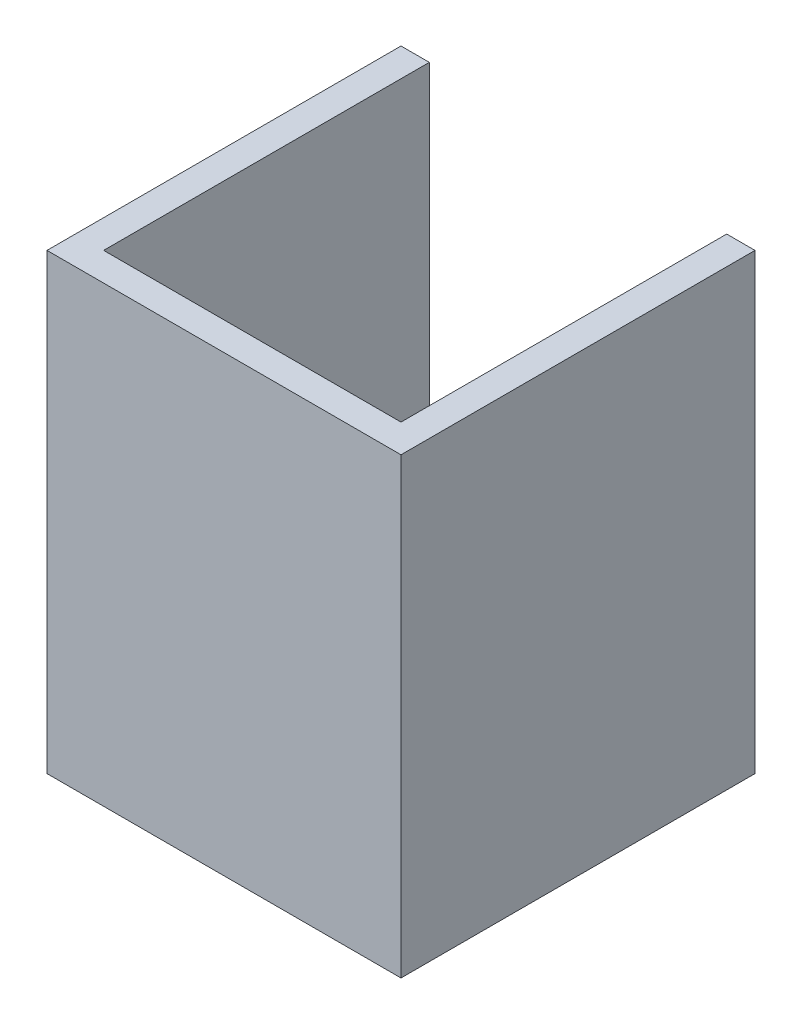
SolidWorks part; units mm, degrees
ref_plane "Front Plane" through (0, 0, 0) normal (0, 0, 1) x (1, 0, 0)
ref_plane "Top Plane" through (0, 0, 0) normal (0, 1, 0) x (1, 0, 0)
ref_plane "Right Plane" through (0, 0, 0) normal (1, 0, 0) x (0, 0, -1)
sketch "Sketch2" plane through (0, 0, 0) normal (0, 0, 1) x (1, 0, 0)
  line L1 (0, 0) -> (25, 0)
  line L2 (0, 0) -> (0, 32)
  line L3 (0, 32) -> (25, 32)
  line L4 (25, 0) -> (25, 32)
  dimension "D1" = 32
  dimension "D2" = 25
extrude "Boss-Extrude1" add sketch "Sketch2" along normal blind 25
shell "Shell1" thickness 2
sketch "Sketch3" plane through (0, 2, 0) normal (0, 1, 0) x (1, 0, 0)
  line L0 (2, 0) -> (23, 0) construction
  line L1 (7.5, 0) -> (17.5, 0)
  line L2 (7.5, 0) -> (7.5, -23)
  line L3 (7.5, -23) -> (17.5, -23)
  line L4 (17.5, 0) -> (17.5, -23)
  line L5 (23, -23) -> (2, -23) construction
  line L6 (12.5, 0.7067) -> (12.5, -26.7322) construction
  line L7 (0, -25) -> (0, 0) construction
  line L8 (25, -25) -> (25, 0) construction
  dimension "D1" = 10
extrude "Cut-Extrude1" cut sketch "Sketch3" against normal through all
